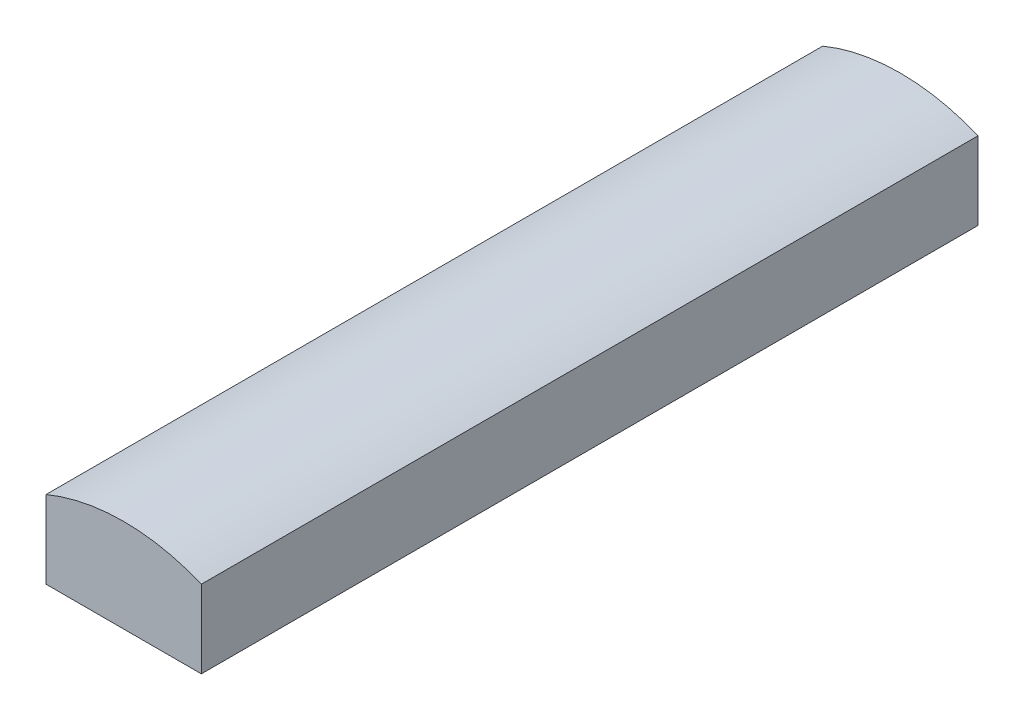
SolidWorks part; units mm, degrees
ref_plane "Vorne" through (0, 0, 0) normal (0, 0, 1) x (1, 0, 0)
ref_plane "Oben" through (0, 0, 0) normal (0, 1, 0) x (1, 0, 0)
ref_plane "Rechts" through (0, 0, 0) normal (1, 0, 0) x (0, 0, -1)
sketch "Skizze1" plane through (0, 0, 0) normal (0, 0, 1) x (1, 0, 0)
  line L0 (550, 50) -> (550, 0) construction
  line L1 (550, 0) -> (450, 0) construction
  line L2 (450, 0) -> (450, 50) construction
  line L3 (550, 50) -> (550, 0)
  line L4 (550, 0) -> (450, 0)
  line L5 (450, 0) -> (450, 50)
  arc A0 (450, 50) -> (550, 50) centre (500, -70) cw
  dimension "D1" = 60
extrude "Linear austragen1" add sketch "Skizze1" against normal up to vertex (500 mm away)
sketch "Skizze4" plane through (0, 0, 0) normal (0, -1, 0) x (1, 0, 0)
  circle A0 centre (500.9509, -479.3457) radius 0.05
  dimension "D1" = 0.1
extrude "Linear austragen3" add sketch "Skizze4" along normal blind 0.1
sketch "Skizze2" plane through (0, 0, 0) normal (0, 0, 1) x (1, 0, 0)
  line L3 (450, 50) -> (450, 0)
  line L4 (450, 0) -> (550, 0)
  line L5 (550, 0) -> (550, 50)
  line L6 (450, 50) -> (450, 0)
  line L7 (450, 0) -> (550, 0)
  line L8 (550, 0) -> (550, 50)
  arc A1 (550, 50) -> (450, 50) centre (500, -70) ccw
  arc A2 (550, 50) -> (450, 50) centre (500, -70) ccw
  dimension "D1" = 0
extrude "Schnitt-Linear austragen1" cut sketch "Skizze2" against normal up to surface (0.1 mm away)
